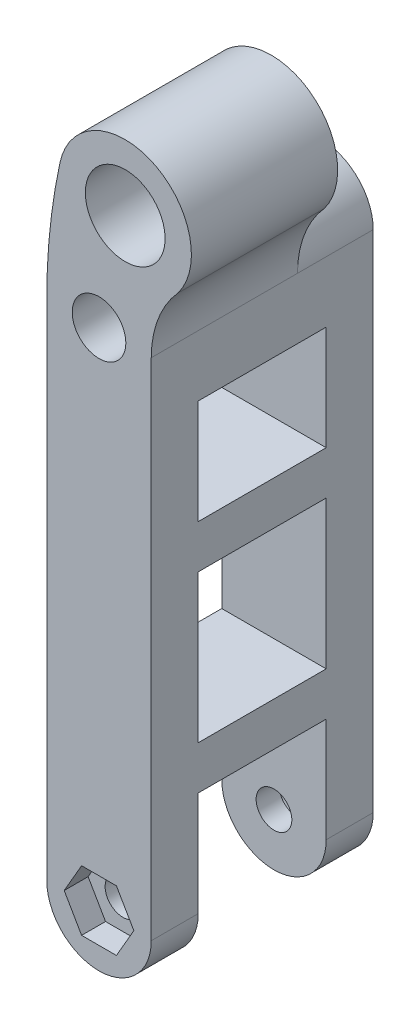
SolidWorks part; units mm, degrees
ref_plane "前视基准面" through (0, 0, 0) normal (0, 0, 1) x (1, 0, 0)
ref_plane "上视基准面" through (0, 0, 0) normal (0, 1, 0) x (1, 0, 0)
ref_plane "右视基准面" through (0, 0, 0) normal (1, 0, 0) x (0, 0, -1)
other "Configuration Table"
sketch "草图1" plane through (0, 0, 0) normal (0, 0, 1) x (1, 0, 0)
  line L2 (0, 0) -> (0, 58)
  line L4 (12, 0) -> (12, 58)
  arc A0 (0, 58) -> (12, 58) centre (6, 58) cw
  arc A1 (12, 0) -> (0, 0) centre (6, 0) cw
  circle A2 centre (6, 58) radius 3.08
  circle A3 centre (6, 0) radius 2.05
  dimension "D1" = 12
  dimension "D2" = 58
extrude "凸台-拉伸7" add sketch "草图1" against normal blind 25.5
sketch "草图6" plane through (12, 0, 0) normal (1, 0, 0) x (0, 0, -1)
  line L1 (5.4, -6) -> (20.1, -6)
  line L2 (5.4, -6) -> (5.4, 12)
  line L3 (5.4, 12) -> (20.1, 12)
  line L4 (20.1, -6) -> (20.1, 12)
  line L5 (0, 0) -> (0, -6) construction
  line L7 (5.4, 17) -> (20.1, 17)
  line L8 (5.4, 17) -> (5.4, 34)
  line L9 (5.4, 34) -> (20.1, 34)
  line L10 (20.1, 17) -> (20.1, 34)
  line L15 (5.4, 39) -> (20.1, 39)
  line L24 (5.4, 39) -> (5.4, 51)
  line L25 (5.4, 51) -> (20.1, 51)
  line L26 (20.1, 39) -> (20.1, 51)
  dimension "D6" = 12
  dimension "D1" = 14.7
  dimension "D2" = 5.4
  dimension "D3" = 5
  dimension "D4" = 5
  dimension "D5" = 17
extrude "切除-拉伸1" cut sketch "草图6" against normal blind 20
ref_plane "中间基准面1" through (0, 0, -12.75) normal (0, 0, -1) x (-1, 0, 0)
sketch "草图8" plane through (0, 0, -12.75) normal (0, 0, -1) x (-1, 0, 0)
  line L0 (-6, 58) -> (-6, 0) construction
  line L1 (-6, 58) -> (-9.0127, 70.646) construction
  line L2 (-12, 58) -> (-12, 56.4998)
  line L3 (-12, 0) -> (-12, 58) construction
  line L4 (-12, 56.4998) -> (-8.2378, 61.5313)
  line L5 (-8.2378, 61.5313) -> (-2.7489, 61.5313)
  line L6 (-2.7489, 61.5313) -> (0, 56.0424)
  line L7 (0, 58) -> (0, 0) construction
  line L8 (0, 56.0424) -> (0, 58)
  circle A0 centre (-9.0127, 70.646) radius 4.58
  circle A1 centre (-9.0127, 70.646) radius 7.65 construction
  arc A4 (-12, 58) -> (-15.0878, 65.9966) centre (-23.8986, 58) ccw
  arc A5 (0, 58) -> (-1.5208, 72.1932) centre (-66.9905, 58) ccw
  arc A6 (-1.5208, 72.1932) -> (-15.0878, 65.9966) centre (-8.9807, 70.5759) ccw
extrude "凸台-拉伸8" add sketch "草图8" against normal blind 12.75 and the other way blind 4.05
sketch "草图9" plane through (0, 0, 0) normal (0, 0, 1) x (1, 0, 0)
  line L1 (10, 0) -> (8, 3.4641)
  line L2 (8, 3.4641) -> (4, 3.4641)
  line L3 (4, 3.4641) -> (2, 0)
  line L4 (2, 0) -> (4, -3.4641)
  line L5 (4, -3.4641) -> (8, -3.4641)
  line L6 (8, -3.4641) -> (10, 0)
  circle A0 centre (6, 0) radius 3.4641 construction
  dimension "D1" = 4
extrude "切除-拉伸2" cut sketch "草图9" against normal blind 2.75
sketch "草图10" plane through (0, 0, -25.5) normal (0, 0, -1) x (-1, 0, 0)
  circle A0 centre (-6, 0) radius 4
  dimension "D1" = 8
extrude "切除-拉伸3" cut sketch "草图10" against normal blind 2.75
